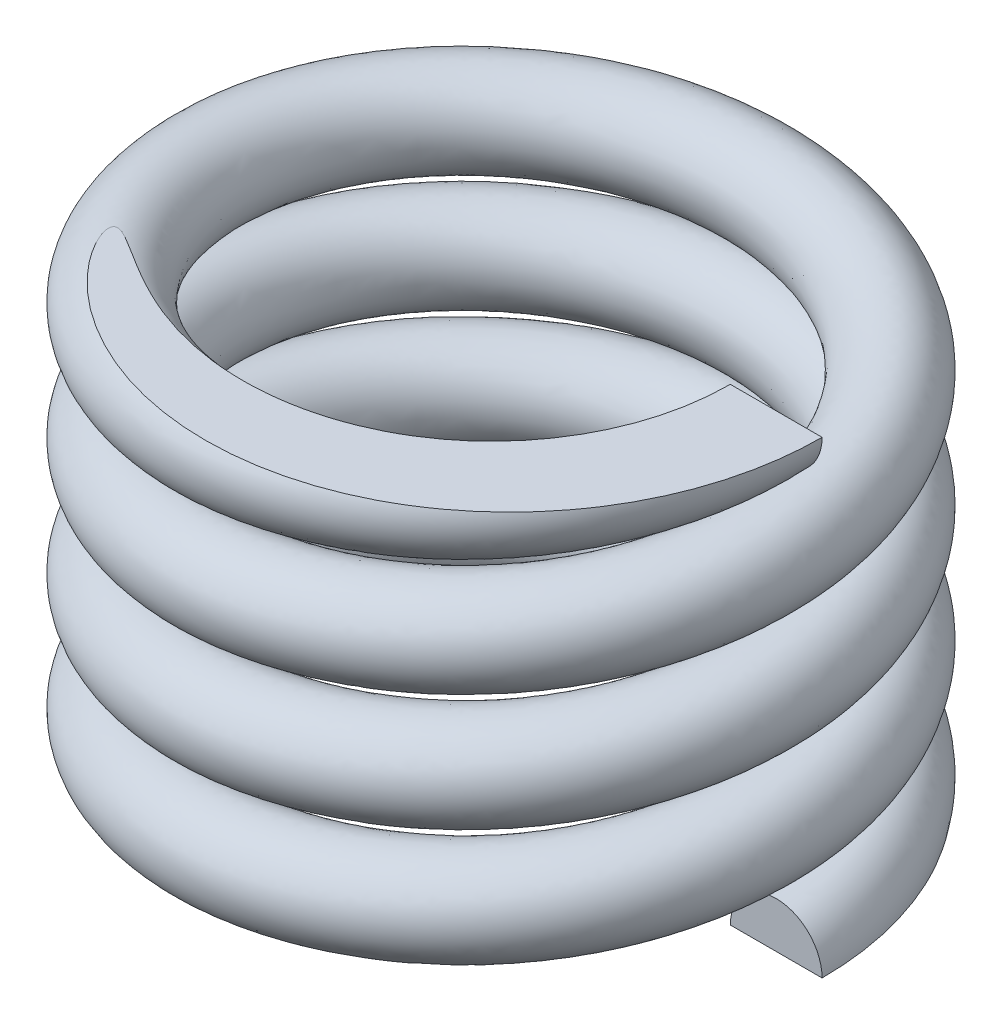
SolidWorks part; units mm, degrees
ref_plane "Front Plane" through (0, 0, 0) normal (0, 0, 1) x (1, 0, 0)
ref_plane "Bottom Plane" through (0, 0, 0) normal (0, 1, 0) x (1, 0, 0)
ref_plane "Right Plane" through (0, 0, 0) normal (1, 0, 0) x (0, 0, -1)
sketch "Sketch1" plane through (0, 0, 0) normal (0, 1, 0) x (1, 0, 0)
  circle A0 centre (0, 0) radius 1.5
  dimension "D1" = 3
sketch "Sketch2" plane through (0, 0, 0) normal (0, 0, 1) x (1, 0, 0)
  circle A0 centre (1.5, 0) radius 0.25
  dimension "D1" = 0.5
sketch "Sketch4" plane through (0, 0, 0) normal (0, 0, 1) x (1, 0, 0)
  line L0 (0, 0) -> (0, 2.5518)
sweep "Sweep1" add profiles "Sketch2" path "Sketch4" parameters "D1"=1440
sketch "Sketch5" plane through (0, 0, 0) normal (0, 1, 0) x (1, 0, 0)
  circle A0 centre (0, 0) radius 1.75
extrude "Cut-Extrude1" cut sketch "Sketch5" against normal through all
ref_plane "Top Plane" through (0, 2.5518, 0) normal (0, 1, 0) x (-1, 0, 0)
sketch "Sketch6" plane through (0, 2.5518, 0) normal (0, 1, 0) x (-1, 0, 0)
  circle A0 centre (0, 0) radius 1.75
extrude "Cut-Extrude2" cut sketch "Sketch6" along normal through all
